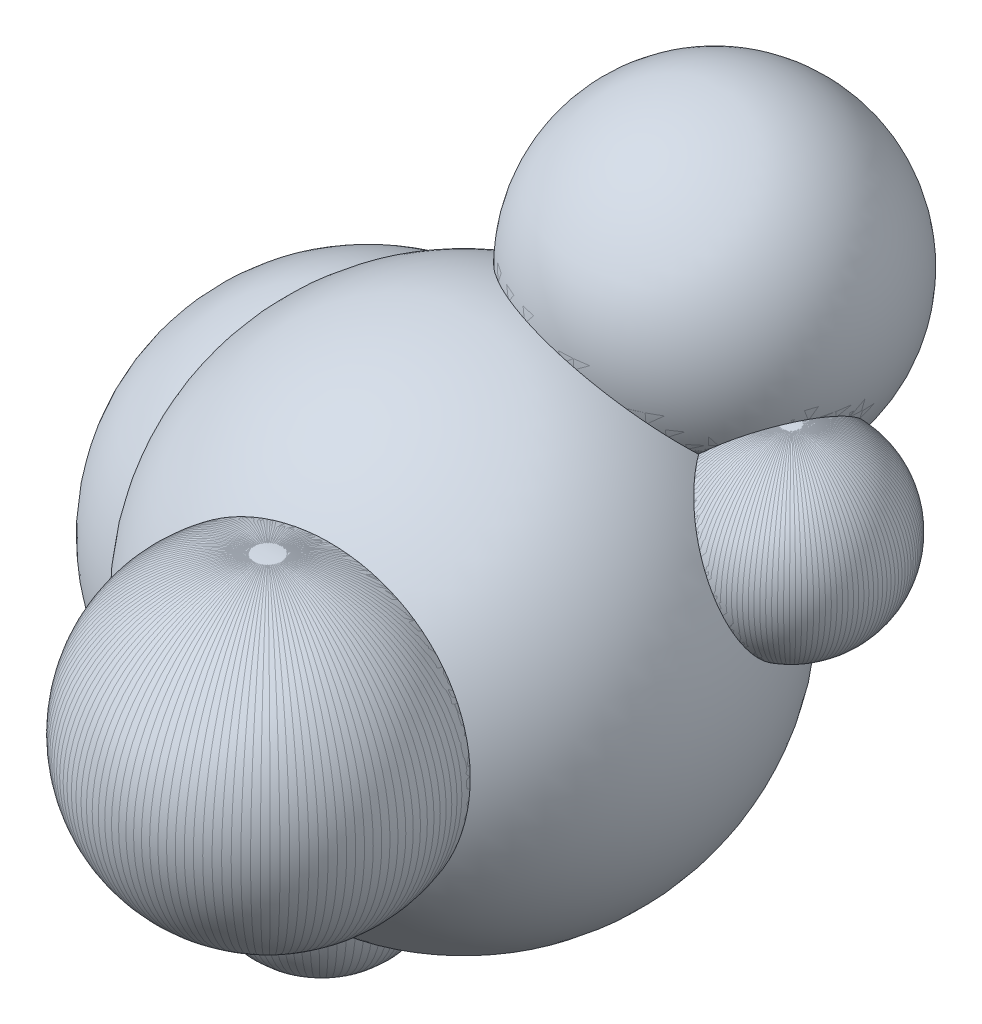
SolidWorks part; units mm, degrees
ref_plane "Front Plane" through (0, 0, 0) normal (0, 0, 1) x (1, 0, 0)
ref_plane "Top Plane" through (0, 0, 0) normal (0, 1, 0) x (1, 0, 0)
ref_plane "Right Plane" through (0, 0, 0) normal (1, 0, 0) x (0, 0, -1)
imported_body "Bubble test 80mm-1-solid1"
imported_body "Bubble test 36mm-1-solid1"
imported_body "Bubble test 30mm-1-solid1"
imported_body "Bubble test 30mm-2-solid1"
imported_body "Bubble test 66mm-1-solid1"
imported_body "Bubble test 50mm-1-solid1"
move or copy body "Body-Move/Copy1" bodies to move or copy 102 105 104 106 101 103 copy yes number of copies 1 translate (0, 0, 0)
combine bodies "Combine1" operation type subtract main body 106 bodies to subtract 111
delete or keep bodies "Body-Delete/Keep 1" type delete bodies bodies 110
combine bodies "Combine2" operation type subtract main body 107 bodies to subtract 112
move or copy body "Body-Move/Copy2" bodies to move or copy 101 copy yes number of copies 1 translate (0, 0, 0)
combine bodies "Combine3" operation type subtract main body 102 bodies to subtract 101
delete or keep bodies "Body-Delete/Keep 2" type delete bodies bodies 118
delete or keep bodies "Body-Delete/Keep 3" type delete bodies bodies 115
move or copy body "Body-Move/Copy3" bodies to move or copy 103 copy yes number of copies 1 translate (0, 0, 0)
move or copy body "Body-Move/Copy5" bodies to move or copy 103 copy yes number of copies 1 translate (0, 0, 0)
combine bodies "Combine4" operation type subtract main body 117 bodies to subtract 103
delete or keep bodies "Body-Delete/Keep 4" type delete bodies bodies 121
delete or keep bodies "Body-Delete/Keep 5" type delete bodies bodies 123
move or copy body "Body-Move/Copy6" bodies to move or copy 116 copy yes number of copies 1 translate (0, 0, 0)
combine bodies "Combine5" operation type subtract main body 119 bodies to subtract 124
combine bodies "Combine6" operation type add bodies to combine 109 105
delete or keep bodies "Body-Delete/Keep 6" type delete bodies bodies 108
move or copy body "Body-Move/Copy7" bodies to move or copy 116 copy yes number of copies 1 translate (0, 0, 0)
combine bodies "Combine7" operation type subtract main body 126 bodies to subtract 127
delete or keep bodies "Body-Delete/Keep 7" type delete bodies bodies 114
delete or keep bodies "Body-Delete/Keep 8" type delete bodies bodies 104
